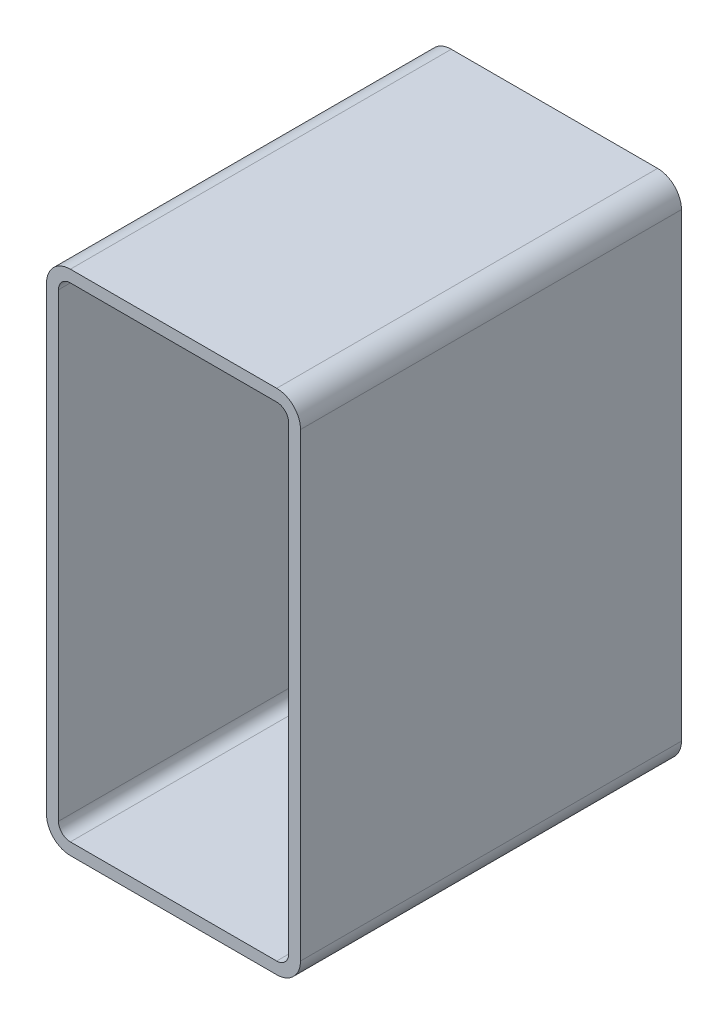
SolidWorks part; units mm, degrees
ref_plane "Front Plane" through (0, 0, 0) normal (0, 0, 1) x (1, 0, 0)
ref_plane "Top Plane" through (0, 0, 0) normal (0, 1, 0) x (1, 0, 0)
ref_plane "Right Plane" through (0, 0, 0) normal (1, 0, 0) x (0, 0, -1)
sketch "Sketch1" plane through (0, 0, 0) normal (0, 0, 1) x (1, 0, 0)
sketch_block_instance "HSS16x8x0.375-1"
sketch_block "HSS16x8x0.375"
extrude "Boss-Extrude1" add sketch "Sketch1" along normal blind 304.8
